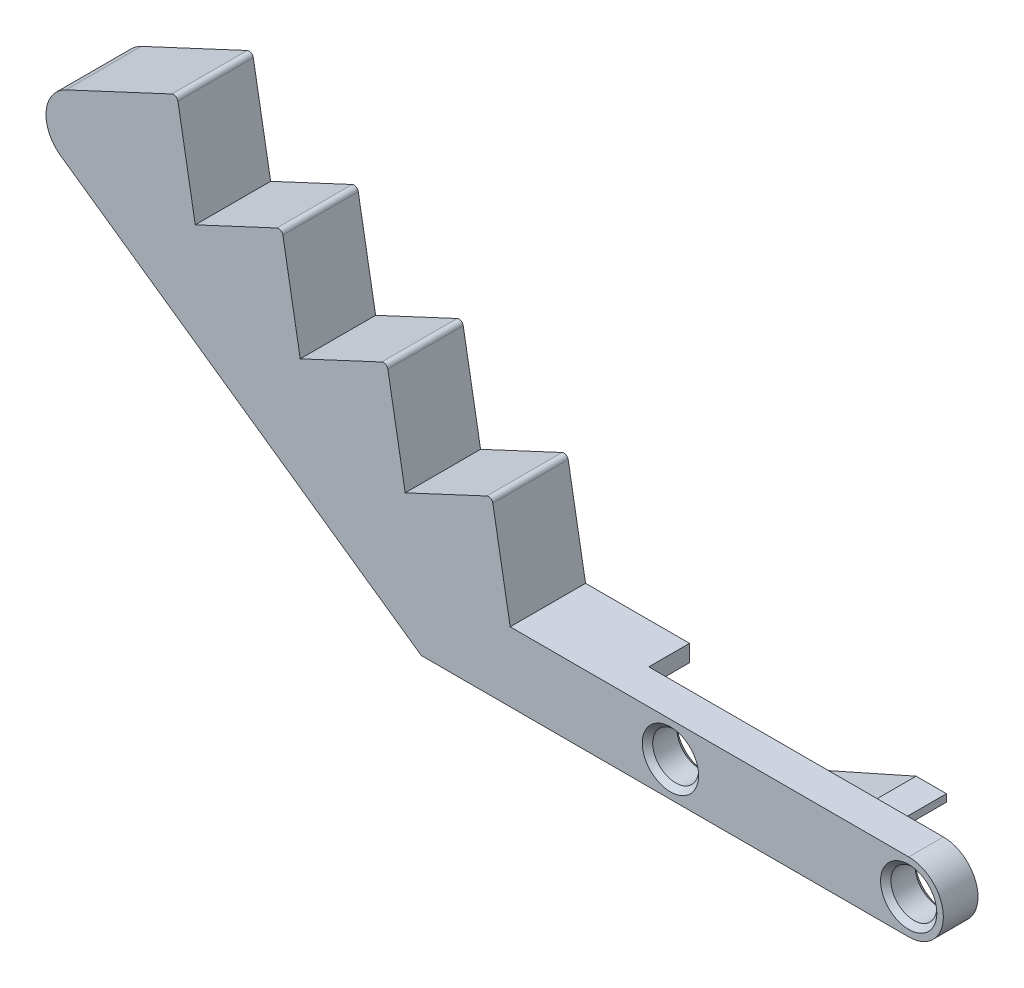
SolidWorks part; units mm, degrees
ref_plane "Alzado" through (0, 0, 0) normal (0, 0, 1) x (1, 0, 0)
ref_plane "Planta" through (0, 0, 0) normal (0, 1, 0) x (1, 0, 0)
ref_plane "Vista lateral" through (0, 0, 0) normal (1, 0, 0) x (0, 0, -1)
sketch "Sketch1" plane through (0, 0, 0) normal (0, 0, 1) x (1, 0, 0)
  line L0 (-27.5, 0) -> (27.5, 0) construction
  line L1 (-27.5, 4) -> (27.5, 4)
  line L2 (-27.5, -4) -> (27.5, -4)
  arc A0 (-27.5, 4) -> (-27.5, -4) centre (-27.5, 0) ccw
  arc A1 (27.5, -4) -> (27.5, 4) centre (27.5, 0) ccw
  point P3 (0, 0)
extrude "Boss-Extrude1" add sketch "Sketch1" along normal blind 4
sketch "Sketch2" plane through (0, 0, 4) normal (0, 0, 1) x (1, 0, 0)
  circle A0 centre (-27.5, 0) radius 2.65
  circle A1 centre (0, 0) radius 2.65
  circle A2 centre (27.5, 0) radius 2.65
extrude "Cut-Extrude1" cut sketch "Sketch2" against normal through all
chamfer "Chamfer2" distance 0.6 angle 45 1 edges at (-24.85, 0, 4)
chamfer "Chamfer3" distance 0.6 angle 45 1 edges at (-24.85, 0, 0)
chamfer "Chamfer4" distance 0.6 angle 45 1 edges at (2.65, 0, 0)
chamfer "Chamfer5" distance 0.6 angle 45 1 edges at (2.65, 0, 4)
chamfer "Chamfer6" distance 0.6 angle 45 1 edges at (30.15, 0, 0)
chamfer "Chamfer7" distance 0.6 angle 45 1 edges at (30.15, 0, 4)
sketch "Sketch5" plane through (0, 0, 0) normal (0, 0, -1) x (-1, 0, 0)
  line L0 (-23.161, 3.8) -> (-23.161, 2.9501)
  line L1 (-23.161, 2.9501) -> (-8, -3.8)
  line L2 (-8, -3.8) -> (-6.5, -3.8)
  line L3 (-6.5, -3.8) -> (-6.5, -2.0596)
  line L4 (-6.5, -2.0596) -> (-19.661, 3.8)
  line L5 (-19.661, 3.8) -> (-23.161, 3.8)
  line L6 (27.5, -4) -> (-27.5, -4) construction
  line L7 (-27.5, 4) -> (27.5, 4) construction
  dimension "D1" = 156
  dimension "D2" = 0.2
  dimension "D3" = 0.2
  dimension "D4" = 2.2
  dimension "D5" = 6.5
  dimension "D6" = 1.5
  dimension "D7" = 3.5
extrude "Boss-Extrude2" add sketch "Sketch5" along normal blind 4.7
mirror "Mirror1" about plane through (0, 0, 0) normal (0, 1, 0) of "Boss-Extrude2"
sketch "Sketch6" plane through (0, 0, -4.7) normal (0, 0, -1) x (-1, 0, 0)
  line L0 (-15.1048, 1.7714) -> (-8.7515, -1.0572)
  line L1 (-13.8305, 1.2041) -> (-19.661, 3.8) construction
  line L2 (-6.5, -2.0596) -> (-11.126, 0) construction
  line L3 (-8.7515, -1.0572) -> (-4.1103, 2.5131)
  line L4 (-4.1103, 2.5131) -> (-7.2468, 7.6014)
  line L5 (-7.2468, 7.6014) -> (-15.1048, 1.7714)
  line L6 (-17.6266, 0.4861) -> (-11.7196, -2.1439)
  line L7 (-23.161, 2.9501) -> (-16.5349, 0) construction
  line L8 (-13.8305, -1.2041) -> (-8, -3.8) construction
  line L9 (-11.7196, -2.1439) -> (-16.6489, -6.3188)
  line L10 (-16.6489, -6.3188) -> (-25.7645, -5.2342)
  line L11 (-25.7645, -5.2342) -> (-21.9821, -0.1889)
  line L12 (-21.9821, -0.1889) -> (-17.6266, 0.4861)
  line L13 (8.5842, 1.1317) -> (14.7037, -1.5929)
  line L14 (6.5, 2.0596) -> (11.126, 0) construction
  line L15 (13.8305, -1.2041) -> (19.661, -3.8) construction
  line L16 (14.7037, -1.5929) -> (6.4424, -5.613)
  line L17 (6.4424, -5.613) -> (4.5258, -0.3828)
  line L18 (4.5258, -0.3828) -> (8.5842, 1.1317)
  line L19 (11.9832, 2.0266) -> (17.7586, -0.5448)
  line L20 (13.8305, 1.2041) -> (8, 3.8) construction
  line L21 (23.161, -2.9501) -> (16.5349, 0) construction
  line L22 (17.7586, -0.5448) -> (24.258, 3.4369)
  line L23 (24.258, 3.4369) -> (16.814, 7.9124)
  line L24 (16.814, 7.9124) -> (11.9832, 2.0266)
extrude "Cut-Extrude2" cut sketch "Sketch6" against normal up to surface (4.7 mm away)
sketch "Sketch7" plane through (0, 0, 0) normal (0, 0, -1) x (-1, 0, 0)
  line L0 (20.1102, -4) -> (28.7612, -4)
  line L2 (28.7612, -4) -> (70.3736, 25.1373)
  line L3 (6.5, 2.0596) -> (20.1102, -4)
  line L4 (6.5, 2.0596) -> (19.661, -3.8) construction
  line L5 (6.5, 2.0596) -> (19.661, -3.8) construction
  line L6 (27.5, -4) -> (-27.5, -4) construction
  line L7 (6.5, 2.0596) -> (6.5, 4)
  line L8 (-27.5, 4) -> (27.5, 4) construction
  line L9 (6.5, 4) -> (18.5, 4)
  line L10 (18.5, 4) -> (20.5028, 15.3583)
  line L11 (21.2065, 15.7246) -> (30.6159, 11.3369)
  line L12 (30.6159, 11.3369) -> (32.6187, 22.6952)
  line L13 (33.3224, 23.0615) -> (42.7318, 18.6738)
  line L14 (42.7318, 18.6738) -> (44.7346, 30.0321)
  line L15 (45.4383, 30.3985) -> (54.8478, 26.0108)
  line L16 (54.8478, 26.0108) -> (56.8505, 37.3691)
  line L17 (57.5543, 37.7354) -> (69.7698, 32.0392)
  arc A2 (27.5, -4) -> (27.5, 4) centre (27.5, 0) ccw construction
  arc A3 (70.3736, 25.1373) -> (69.7698, 32.0392) centre (68.0793, 28.414) ccw
  arc A4 (57.5543, 37.7354) -> (56.8505, 37.3691) centre (57.3429, 37.2822) ccw
  arc A5 (45.4383, 30.3985) -> (44.7346, 30.0321) centre (45.227, 29.9453) ccw
  arc A6 (33.3224, 23.0615) -> (32.6187, 22.6952) centre (33.1111, 22.6084) ccw
  arc A7 (21.2065, 15.7246) -> (20.5028, 15.3583) centre (20.9952, 15.2715) ccw
  point P33 (56.9637, 38.0108)
  point P36 (44.8478, 30.6738)
  point P39 (32.7318, 23.3369)
  point P42 (20.6159, 16)
  dimension "D18" = 4
  dimension "D19" = 0.5
  dimension "D1" = 145
  dimension "D2" = 12
  dimension "D3" = 100
  dimension "D4" = 12
  dimension "D5" = 100
  dimension "D6" = 75
  dimension "D7" = 12
  dimension "D8" = 10
  dimension "D9" = 100
  dimension "D10" = 10
  dimension "D11" = 12
  dimension "D12" = 75
  dimension "D13" = 10
  dimension "D14" = 12
  dimension "D15" = 100
  dimension "D16" = 75
  dimension "D17" = 75
extrude "Boss-Extrude3" add sketch "Sketch7" along normal up to surface and the other way up to surface
equation "\"largo\"= 55"
equation "\"ancho\"= 8"
equation "\"thick_c\"= 1.5"
equation "\"c\"= 5.3"
equation "\"chan_1\"= 0.6"
equation "\"D1@Sketch1\"=\"largo\""
equation "\"D1@Boss-Extrude1\"=\"thick\""
equation "\"D1@Sketch2\"=\"largo\"/2"
equation "\"D2@Sketch2\"=\"largo\"/2"
equation "\"thick\"= 4"
equation "\"D3@Sketch2\"=\"c\""
equation "\"D4@Sketch2\"=\"c\""
equation "\"D5@Sketch2\"=\"c\""
equation "\"D1@Chamfer2\"=\"chan_1\""
equation "\"D1@Chamfer4\"=\"chan_1\""
equation "\"D1@Chamfer5\"=\"chan_1\""
equation "\"D1@Chamfer6\"=\"chan_1\""
equation "\"D1@Chamfer7\"=\"chan_1\""
equation "\"D2@Sketch1\"=\"ancho\""
equation "\"D1@Chamfer3\"=\"chan_1\""
